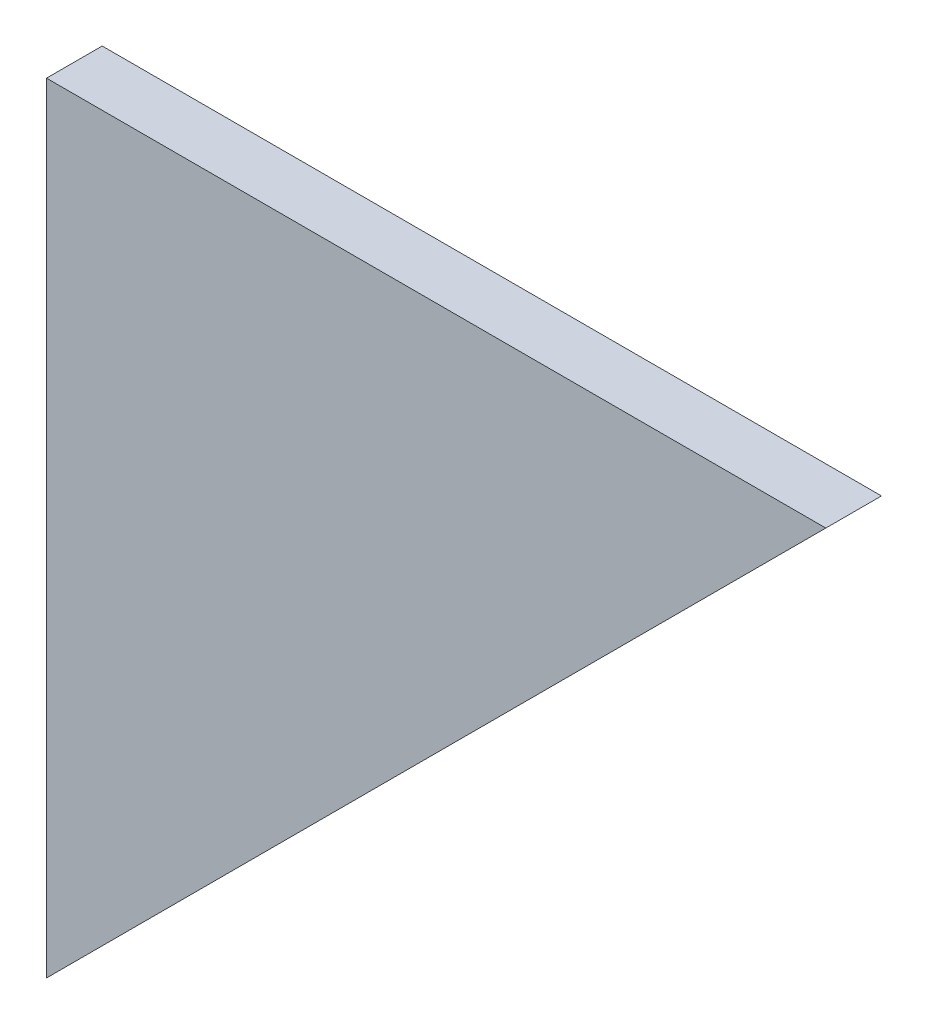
SolidWorks part; units mm, degrees
ref_plane "Face" through (0, 0, 0) normal (0, 0, 1) x (1, 0, 0)
ref_plane "Dessus" through (0, 0, 0) normal (0, 1, 0) x (1, 0, 0)
ref_plane "Droite" through (0, 0, 0) normal (1, 0, 0) x (0, 0, -1)
sketch "Esquisse1" plane through (0, 0, 0) normal (0, 0, 1) x (1, 0, 0)
  line L0 (70, 0) -> (0, -70)
  line L1 (0, 0) -> (70, 0)
  line L2 (0, 0) -> (0, -70)
  dimension "D1" = 70
  dimension "D2" = 70
extrude "Base-Extrusion" add sketch "Esquisse1" along normal blind 5
